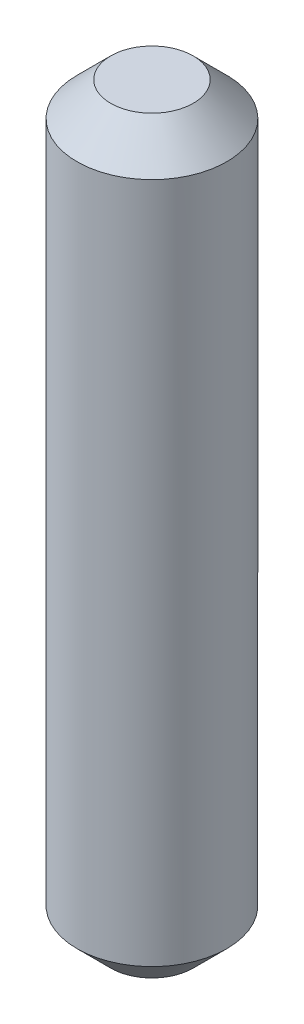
SolidWorks part; units mm, degrees
ref_plane "Front Plane" through (0, 0, 0) normal (0, 0, 1) x (1, 0, 0)
ref_plane "Top Plane" through (0, 0, 0) normal (0, 1, 0) x (1, 0, 0)
ref_plane "Right Plane" through (0, 0, 0) normal (1, 0, 0) x (0, 0, -1)
sketch "Sketch1" plane through (0, 0, 0) normal (0, 0, 1) x (1, 0, 0)
  line L0 (0, 0) -> (0, 2.1899) construction
  line L1 (-1, 5) -> (1, 5) construction
  line L2 (-1, 5) -> (-1, -5)
  line L3 (-1, -5) -> (1, -5) construction
  line L4 (1, 5) -> (1, -5) construction
  line L5 (-1, 5) -> (1, -5) construction
  line L6 (-1, -5) -> (1, 5) construction
  line L7 (-1, 5) -> (0, 5)
  line L8 (-1, -5) -> (0, -5)
  line L9 (0, 5) -> (0, -5)
  point P0 (0, 0)
  dimension "D1" = 2
  dimension "D2" = 10
revolve "Revolve1" add sketch "Sketch1" angle 360 about L9
chamfer "Chamfer1" distance 0.45 angle 45 2 edges at (-1, 5, 0) (-1, -5, 0)
